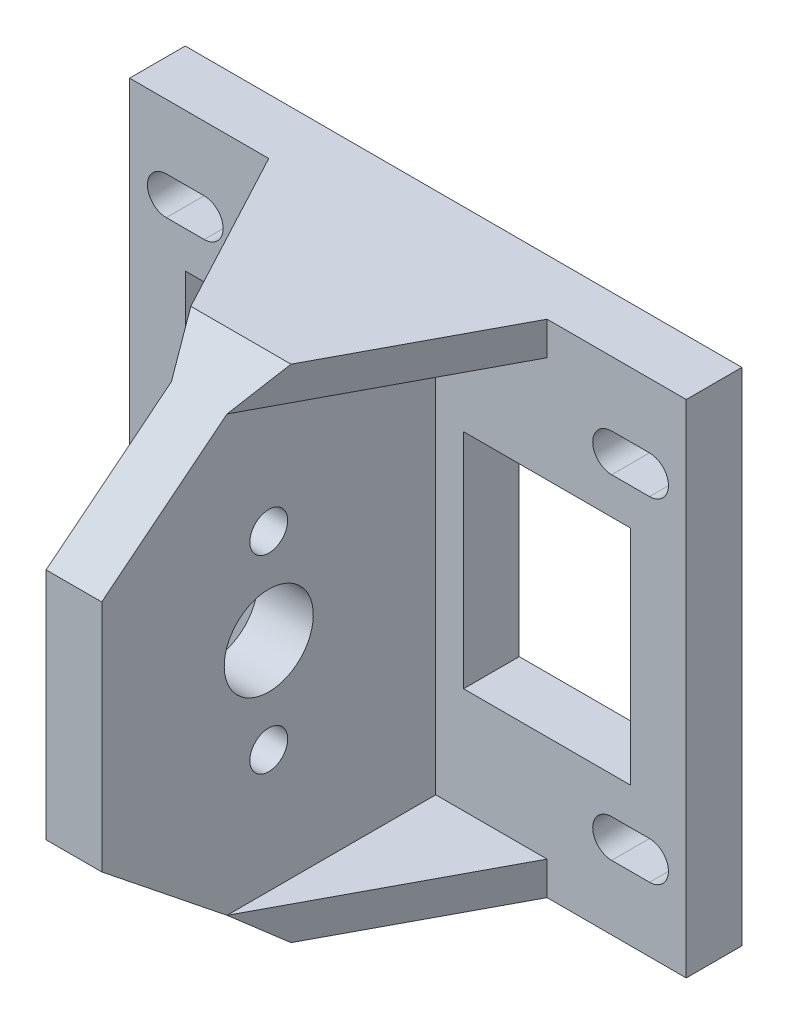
SolidWorks part; units mm, degrees
ref_plane "前视基准面" through (0, 0, 0) normal (0, 0, 1) x (1, 0, 0)
ref_plane "上视基准面" through (0, 0, 0) normal (0, 1, 0) x (1, 0, 0)
ref_plane "右视基准面" through (0, 0, 0) normal (1, 0, 0) x (0, 0, -1)
sketch "草图1" plane through (0, 0, 0) normal (0, 0, 1) x (1, 0, 0)
  line L1 (-25, 22.5) -> (25, 22.5)
  line L2 (-25, 22.5) -> (-25, -22.5)
  line L3 (-25, -22.5) -> (25, -22.5)
  line L4 (25, 22.5) -> (25, -22.5)
  line L5 (-25, 22.5) -> (25, -22.5) construction
  line L6 (-25, -22.5) -> (25, 22.5) construction
  point P0 (0, 0)
  dimension "D1" = 45
  dimension "D2" = 50
extrude "凸台-拉伸1" add sketch "草图1" along normal blind 5
sketch "草图2" plane through (0, 0, 5) normal (0, 0, 1) x (1, 0, 0)
  line L0 (-25, -22.5) -> (25, -22.5) construction
  line L1 (-2.5, 22.5) -> (2.5, 22.5)
  line L2 (-2.5, 22.5) -> (-2.5, -22.5)
  line L3 (-2.5, -22.5) -> (2.5, -22.5)
  line L4 (2.5, 22.5) -> (2.5, -22.5)
  dimension "D1" = 5
  dimension "D2" = 2.5
extrude "凸台-拉伸2" add sketch "草图2" along normal blind 30
sketch "草图3" plane through (0, 22.5, 0) normal (0, 1, 0) x (1, 0, 0)
  line L0 (2.5, -35) -> (2.5, -5)
  line L1 (2.5, -5) -> (25, -5)
  line L2 (25, -5) -> (2.5, -35)
extrude "凸台-拉伸3" [suppressed] add sketch "草图3" against normal blind 3
ref_plane "基准面1" through (0, 0, 0) normal (0, 1, 0) x (1, 0, 0)
mirror "镜向1" [suppressed] about plane through (0, 0, 0) normal (0, 1, 0)
sketch "草图4" plane through (2.5, 0, 0) normal (1, 0, 0) x (0, 0, -1)
  line L0 (-5, -22.5) -> (-5, 22.5) construction
  circle A0 centre (-20, 0) radius 4
  dimension "D1" = 8
  dimension "D2" = 15
extrude "切除-拉伸1" cut sketch "草图4" against normal through all
hole_wizard "Ø3.4 (3.4) 直径孔1" positions "草图5" profile "草图6" hole size "Ø3.4" standard "GB"
sketch "草图5" plane through (-25, 0, 0) normal (-1, 0, 0) x (0, 0, 1)
  circle A0 centre (20, 0) radius 4 construction
  point P0 (20, -8.5)
  point P2 (20, 8.5)
  dimension "D1" = 17
  dimension "D2" = 8.5
  dimension "D3" = 20
  dimension "D4" = 20
sketch "草图6" plane through (-25, -8.5, 20) normal (0, 1, 0) x (0, 0, 1)
  line L0 (0, 0) -> (0, 50)
  line L1 (0, 50) -> (1.7, 50)
  line L2 (1.7, 50) -> (1.7, 0)
  line L5 (1.7, 0) -> (0, 0)
  line L11 (0, -6.35) -> (0, 107.95) construction
  dimension "通孔孔直径" = 3.4
  dimension "通孔孔深度" = 50
hole_wizard "Ø3.4 (3.4) 直径孔2" positions "草图7" profile "草图8" hole size "Ø3.4" standard "GB"
sketch "草图7" plane through (0, 0, 5) normal (0, 0, 1) x (1, 0, 0)
  point P0 (20, 15)
  point P2 (-20, 15)
  point P4 (20, -15)
  point P6 (-20, -15)
  dimension "D1" = 30
  dimension "D2" = 30
  dimension "D3" = 15
  dimension "D4" = 15
  dimension "D5" = 40
  dimension "D6" = 20
  dimension "D7" = 20
  dimension "D8" = 20
sketch "草图8" plane through (20, 15, 5) normal (1, 0, 0) x (0, -1, 0)
  line L0 (0, 0) -> (0, 5)
  line L1 (0, 5) -> (1.7, 5)
  line L2 (1.7, 5) -> (1.7, 0)
  line L5 (1.7, 0) -> (0, 0)
  line L11 (0, -6.35) -> (0, 107.95) construction
  dimension "通孔孔直径" = 3.4
  dimension "通孔孔深度" = 5
sketch "草图9" plane through (0, 22.5, 0) normal (0, 1, 0) x (1, 0, 0)
  line L0 (-12.5, -5) -> (-2.5, -5)
  line L1 (-2.5, -5) -> (-2.5, -35)
  line L2 (-2.5, -35) -> (-12.5, -5)
  line L3 (2.5, -5) -> (2.5, -35)
  line L4 (2.5, -35) -> (12.5, -5)
  line L5 (12.5, -5) -> (2.5, -5)
  dimension "D1" = 10
  dimension "D2" = 10
extrude "凸台-拉伸4" add sketch "草图9" against normal blind 3
ref_plane "基准面2" through (0, 0, 0) normal (0, 1, 0) x (1, 0, 0)
mirror "镜向2" about plane through (0, 0, 0) normal (0, 1, 0) of "凸台-拉伸4"
sketch "草图10" plane through (0, 0, 5) normal (0, 0, 1) x (1, 0, 0)
  line L0 (-25, 22.5) -> (-25, -22.5) construction
  line L1 (-37.5, 7.5) -> (-12.5, 7.5)
  line L2 (-37.5, 7.5) -> (-37.5, -7.5)
  line L3 (-37.5, -7.5) -> (-12.5, -7.5)
  line L4 (-12.5, 7.5) -> (-12.5, -7.5)
  line L5 (-37.5, 7.5) -> (-12.5, -7.5) construction
  line L6 (-37.5, -7.5) -> (-12.5, 7.5) construction
  line L7 (-2.5, 19.5) -> (-2.5, -19.5) construction
  point P0 (-25, 0)
  dimension "D1" = 15
  dimension "D2" = 10
extrude "切除-拉伸2" [suppressed] cut sketch "草图10" against normal through all
sketch "草图11" plane through (0, 0, 5) normal (0, 0, 1) x (1, 0, 0)
  line L0 (-22.5, 15) -> (-17.5, 15) construction
  line L1 (-22.5, 16.7) -> (-17.5, 16.7)
  line L2 (-22.5, 13.3) -> (-17.5, 13.3)
  line L3 (17.5, 15) -> (22.5, 15) construction
  line L4 (17.5, 16.7) -> (22.5, 16.7)
  line L5 (17.5, 13.3) -> (22.5, 13.3)
  line L6 (-22.5, -15) -> (-17.5, -15) construction
  line L7 (-22.5, -13.3) -> (-17.5, -13.3)
  line L8 (-22.5, -16.7) -> (-17.5, -16.7)
  line L9 (17.5, -15) -> (22.5, -15) construction
  line L10 (17.5, -13.3) -> (22.5, -13.3)
  line L11 (17.5, -16.7) -> (22.5, -16.7)
  arc A1 (-22.5, 16.7) -> (-22.5, 13.3) centre (-22.5, 15) ccw
  arc A2 (-17.5, 13.3) -> (-17.5, 16.7) centre (-17.5, 15) ccw
  arc A4 (17.5, 16.7) -> (17.5, 13.3) centre (17.5, 15) ccw
  arc A5 (22.5, 13.3) -> (22.5, 16.7) centre (22.5, 15) ccw
  arc A8 (-22.5, -13.3) -> (-22.5, -16.7) centre (-22.5, -15) ccw
  arc A9 (-17.5, -16.7) -> (-17.5, -13.3) centre (-17.5, -15) ccw
  arc A11 (17.5, -13.3) -> (17.5, -16.7) centre (17.5, -15) ccw
  arc A12 (22.5, -16.7) -> (22.5, -13.3) centre (22.5, -15) ccw
  point P2 (20, 15)
  point P5 (-20, 15)
  point P16 (-20, -15)
  point P23 (20, -15)
  dimension "D1" = 1.7
  dimension "D2" = 1.7
  dimension "D3" = 1.7
  dimension "D4" = 1.7
  dimension "D5" = 5
  dimension "D6" = 5
  dimension "D7" = 5
  dimension "D8" = 5
extrude "切除-拉伸3" [suppressed] cut sketch "草图11" against normal through all
mirror "镜向3" [suppressed] about plane through (0, 0, 0) normal (1, 0, 0)
sketch "草图12" plane through (2.5, 0, 0) normal (1, 0, 0) x (0, 0, -1)
  circle A0 centre (-20, 0) radius 13
  dimension "D1" = 26
extrude "切除-拉伸4" [suppressed] cut sketch "草图12" against normal blind 2
sketch "草图13" plane through (0, 0, 5) normal (0, 0, 1) x (1, 0, 0)
  line L0 (-25, 22.5) -> (-25, -22.5) construction
  line L1 (-20, 10) -> (-5, 10)
  line L2 (-20, 10) -> (-20, -10)
  line L3 (-20, -10) -> (-5, -10)
  line L4 (-5, 10) -> (-5, -10)
  dimension "D1" = 15
  dimension "D2" = 20
  dimension "D3" = 10
  dimension "D4" = 5
extrude "切除-拉伸5" cut sketch "草图13" against normal through all
mirror "镜向4" about plane through (0, 0, 0) normal (1, 0, 0) of "切除-拉伸5"
sketch "草图14" plane through (-2.5, 0, 0) normal (-1, 0, 0) x (0, 0, 1)
  circle A0 centre (20, 8.5) radius 3
  circle A1 centre (20, -8.5) radius 3
  dimension "D1" = 6
  dimension "D2" = 6
extrude "切除-拉伸6" cut sketch "草图14" against normal blind 2
sketch "草图15" plane through (0, 0, 5) normal (0, 0, 1) x (1, 0, 0)
  line L0 (-21.7, 15) -> (-18.3, 15) construction
  line L1 (-21.7, 16.7) -> (-18.3, 16.7)
  line L2 (-21.7, 13.3) -> (-18.3, 13.3)
  line L3 (18.3, 15) -> (21.7, 15) construction
  line L4 (18.3, 16.7) -> (21.7, 16.7)
  line L5 (18.3, 13.3) -> (21.7, 13.3)
  line L6 (-21.7, -15) -> (-18.3, -15) construction
  line L7 (-21.7, -13.3) -> (-18.3, -13.3)
  line L8 (-21.7, -16.7) -> (-18.3, -16.7)
  line L9 (18.3, -15) -> (21.7, -15) construction
  line L10 (18.3, -13.3) -> (21.7, -13.3)
  line L11 (18.3, -16.7) -> (21.7, -16.7)
  circle A0 centre (-20, 15) radius 1.7 construction
  arc A1 (-21.7, 16.7) -> (-21.7, 13.3) centre (-21.7, 15) ccw
  arc A2 (-18.3, 13.3) -> (-18.3, 16.7) centre (-18.3, 15) ccw
  circle A3 centre (20, 15) radius 1.7 construction
  arc A4 (18.3, 16.7) -> (18.3, 13.3) centre (18.3, 15) ccw
  arc A5 (21.7, 13.3) -> (21.7, 16.7) centre (21.7, 15) ccw
  circle A6 centre (-20, -15) radius 1.7 construction
  arc A7 (-21.7, -13.3) -> (-21.7, -16.7) centre (-21.7, -15) ccw
  arc A8 (-18.3, -16.7) -> (-18.3, -13.3) centre (-18.3, -15) ccw
  circle A9 centre (20, -15) radius 1.7 construction
  arc A10 (18.3, -13.3) -> (18.3, -16.7) centre (18.3, -15) ccw
  arc A11 (21.7, -16.7) -> (21.7, -13.3) centre (21.7, -15) ccw
  point P5 (-20, 15)
  point P10 (20, 15)
  point P20 (-20, -15)
  point P30 (20, -15)
  dimension "D1" = 1.7
  dimension "D2" = 1.7
  dimension "D3" = 1.7
  dimension "D4" = 1.7
extrude "切除-拉伸7" cut sketch "草图15" against normal through all
sketch "草图18" plane through (25, 0, 0) normal (1, 0, 0) x (0, 0, -1)
  line L0 (-35, 22.5) -> (-35, 10.5)
  line L1 (-35, -19.5) -> (-35, 19.5) construction
  line L2 (-35, 10.5) -> (-20, 22.5)
  line L3 (-35, 22.5) -> (-5, 22.5) construction
  line L4 (-20, 22.5) -> (-35, 22.5)
  line L5 (-35, -22.5) -> (-35, -10.5)
  line L6 (-35, -10.5) -> (-20, -22.5)
  line L7 (-35, -22.5) -> (-5, -22.5) construction
  line L8 (-20, -22.5) -> (-35, -22.5)
  dimension "D1" = 12
  dimension "D2" = 12
extrude "切除-拉伸9" cut sketch "草图18" against normal through all
sketch "草图19" plane through (0, 22.5, 0) normal (0, 1, 0) x (1, 0, 0)
  line L0 (-2.5, -23.75) -> (-12.5, -5)
  line L1 (-12.5, -5) -> (-6.25, -23.75)
  line L2 (-6.25, -23.75) -> (-2.5, -23.75)
  line L3 (2.5, -23.75) -> (12.5, -5)
  line L4 (12.5, -5) -> (6.25, -23.75)
  line L5 (6.25, -23.75) -> (2.5, -23.75)
extrude "切除-拉伸10" cut sketch "草图19" against normal through all
equation "\"3、\"=10"
